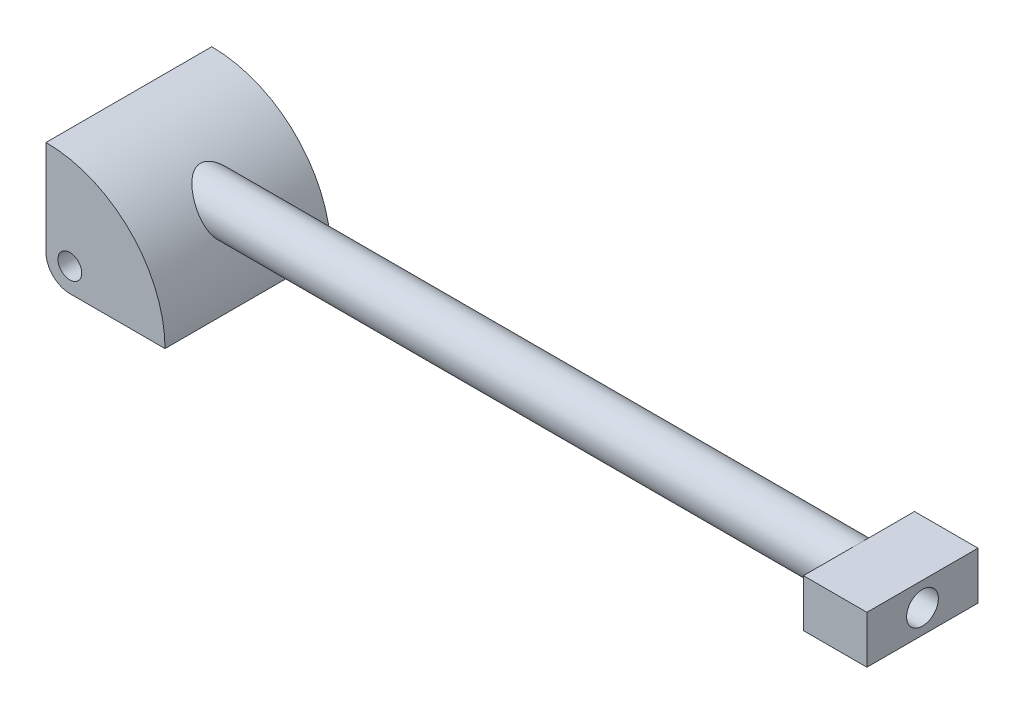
SolidWorks part; units mm, degrees
ref_plane "Front Plane" through (0, 0, 0) normal (0, 0, 1) x (1, 0, 0)
ref_plane "Top Plane" through (0, 0, 0) normal (0, 1, 0) x (1, 0, 0)
ref_plane "Right Plane" through (0, 0, 0) normal (1, 0, 0) x (0, 0, -1)
sketch "Sketch1" plane through (0, 0, 0) normal (0, 0, 1) x (1, 0, 0)
  line L0 (-19.05, 0) -> (-19.05, 76.2)
  line L1 (0, -19.05) -> (76.2, -19.05)
  arc A0 (-19.05, 0) -> (0, -19.05) centre (0, 0) ccw
  circle A1 centre (0, 0) radius 9.525
  arc A2 (-19.05, 76.2) -> (76.2, -19.05) centre (-19.05, -19.05) cw
  dimension "D2" = 19.05
  dimension "D5" = 95.25
  dimension "D3" = 76.2
  dimension "D4" = 76.2
  dimension "D6" = 19.05
  dimension "D7" = 19.05
extrude "Boss-Extrude1" add sketch "Sketch1" against normal blind 132.6642
sketch "Sketch2" plane through (-19.05, 0, 0) normal (-1, 0, 0) x (0, 0, 1)
  circle A0 centre (-66.3321, 38.1) radius 19.05
  point P5 (-56.3389, 41.6431)
  dimension "D1" = 38.1
  dimension "D2" = 38.1
  dimension "D3" = 66.3321
extrude "Boss-Extrude2" add sketch "Sketch2" against normal blind 635
sketch "Sketch3" plane through (615.95, 0, 0) normal (1, 0, 0) x (0, 0, -1)
  line L1 (21.8821, 57.15) -> (110.7821, 57.15)
  line L2 (21.8821, 57.15) -> (21.8821, 19.05)
  line L3 (21.8821, 19.05) -> (110.7821, 19.05)
  line L4 (110.7821, 57.15) -> (110.7821, 19.05)
  circle A1 centre (66.3321, 38.1) radius 19.05 construction
  dimension "D1" = 38.1
  dimension "D2" = 88.9
  dimension "D3" = 44.45
  dimension "D4" = 19.05
extrude "Boss-Extrude3" add sketch "Sketch3" against normal blind 50.8
sketch "Sketch4" plane through (615.95, 0, 0) normal (1, 0, 0) x (0, 0, -1)
  circle A0 centre (66.3321, 38.1) radius 12.7
  dimension "D1" = 25.4
extrude "Cut-Extrude1" cut sketch "Sketch4" against normal offset from surface (624.84 mm away) 10.16
